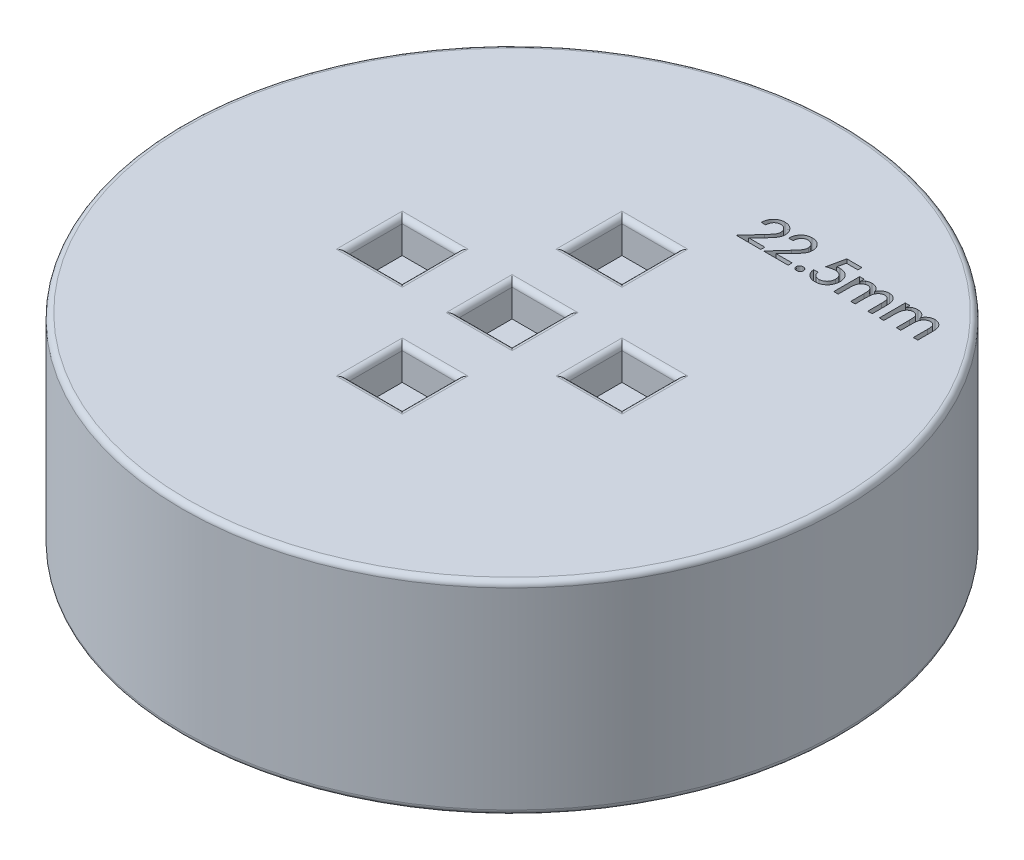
SolidWorks part; units mm, degrees
ref_plane "Front Plane" through (0, 0, 0) normal (0, 0, 1) x (1, 0, 0)
ref_plane "Top Plane" through (0, 0, 0) normal (0, 1, 0) x (1, 0, 0)
ref_plane "Right Plane" through (0, 0, 0) normal (1, 0, 0) x (0, 0, -1)
sketch "Sketch1" plane through (0, 0, 0) normal (0, 1, 0) x (1, 0, 0)
  circle A0 centre (0, 0) radius 30
extrude "Boss-Extrude1" add sketch "Sketch1" along normal blind 18.5
sketch "Sketch2" plane through (0, 18.5, 0) normal (0, 1, 0) x (1, 0, 0)
  line L0 (0, 0) -> (0, -10) construction
  line L1 (0, 0) -> (10, 0) construction
  line L2 (0, 0) -> (-10, 0) construction
  line L3 (0, 0) -> (0, 10) construction
  line L5 (-2.5, -7.5) -> (2.5, -7.5)
  line L6 (-2.5, -7.5) -> (-2.5, -12.5)
  line L7 (-2.5, -12.5) -> (2.5, -12.5)
  line L8 (2.5, -7.5) -> (2.5, -12.5)
  line L9 (-2.5, -7.5) -> (2.5, -12.5) construction
  line L10 (-2.5, -12.5) -> (2.5, -7.5) construction
  line L11 (-7.5, -2.5) -> (-12.5, -2.5)
  line L12 (-7.5, -2.5) -> (-7.5, 2.5)
  line L13 (-7.5, 2.5) -> (-12.5, 2.5)
  line L14 (-12.5, -2.5) -> (-12.5, 2.5)
  line L15 (-7.5, -2.5) -> (-12.5, 2.5) construction
  line L16 (-7.5, 2.5) -> (-12.5, -2.5) construction
  line L17 (2.5, -2.5) -> (-2.5, -2.5)
  line L18 (2.5, -2.5) -> (2.5, 2.5)
  line L19 (2.5, 2.5) -> (-2.5, 2.5)
  line L20 (-2.5, -2.5) -> (-2.5, 2.5)
  line L21 (2.5, -2.5) -> (-2.5, 2.5) construction
  line L22 (2.5, 2.5) -> (-2.5, -2.5) construction
  line L23 (-2.5, 12.5) -> (2.5, 12.5)
  line L24 (-2.5, 12.5) -> (-2.5, 7.5)
  line L25 (-2.5, 7.5) -> (2.5, 7.5)
  line L26 (2.5, 12.5) -> (2.5, 7.5)
  line L27 (-2.5, 12.5) -> (2.5, 7.5) construction
  line L28 (-2.5, 7.5) -> (2.5, 12.5) construction
  line L29 (12.5, -2.5) -> (7.5, -2.5)
  line L30 (12.5, -2.5) -> (12.5, 2.5)
  line L31 (12.5, 2.5) -> (7.5, 2.5)
  line L32 (7.5, -2.5) -> (7.5, 2.5)
  line L33 (12.5, -2.5) -> (7.5, 2.5) construction
  line L34 (12.5, 2.5) -> (7.5, -2.5) construction
  dimension "D1" = 5
  dimension "D2" = 10
  dimension "D3" = 5
  dimension "D4" = 5
  dimension "D5" = 5
  dimension "D6" = 5
  dimension "D7" = 5
  dimension "D8" = 5
extrude "Cut-Extrude1" cut sketch "Sketch2" against normal blind 3
fillet "Fillet1" radius 0.5 6 edges at (2.5, 18.5, 0) (0, 18.5, 2.5) (-12.5, 18.5, 0) (-10, 18.5, 2.5) (-7.5, 18.5, 0) (-10, 18.5, -2.5)
sketch "Sketch3" plane through (0, 18.5, 0) normal (0, 1, 0) x (1, 0, 0)
sketch "Sketch4" plane through (0, 0, 0) normal (0, -1, 0) x (-1, 0, 0)
  line L0 (0, 0) -> (-10, 0) construction
  line L1 (0, 0) -> (0, -10) construction
  line L2 (0, 0) -> (0, 10) construction
  line L3 (0, 0) -> (10, 0) construction
  line L5 (-2.5, 2.5) -> (2.5, 2.5)
  line L6 (-2.5, 2.5) -> (-2.5, -2.5)
  line L7 (-2.5, -2.5) -> (2.5, -2.5)
  line L8 (2.5, 2.5) -> (2.5, -2.5)
  line L9 (-2.5, 2.5) -> (2.5, -2.5) construction
  line L10 (-2.5, -2.5) -> (2.5, 2.5) construction
  line L11 (-2.5, -7.5) -> (2.5, -7.5)
  line L12 (-2.5, -7.5) -> (-2.5, -12.5)
  line L13 (-2.5, -12.5) -> (2.5, -12.5)
  line L14 (2.5, -7.5) -> (2.5, -12.5)
  line L15 (-2.5, -7.5) -> (2.5, -12.5) construction
  line L16 (-2.5, -12.5) -> (2.5, -7.5) construction
  line L17 (7.5, 2.5) -> (12.5, 2.5)
  line L18 (7.5, 2.5) -> (7.5, -2.5)
  line L19 (7.5, -2.5) -> (12.5, -2.5)
  line L20 (12.5, 2.5) -> (12.5, -2.5)
  line L21 (7.5, 2.5) -> (12.5, -2.5) construction
  line L22 (7.5, -2.5) -> (12.5, 2.5) construction
  line L23 (-12.5, 2.5) -> (-7.5, 2.5)
  line L24 (-12.5, 2.5) -> (-12.5, -2.5)
  line L25 (-12.5, -2.5) -> (-7.5, -2.5)
  line L26 (-7.5, 2.5) -> (-7.5, -2.5)
  line L27 (-12.5, 2.5) -> (-7.5, -2.5) construction
  line L28 (-12.5, -2.5) -> (-7.5, 2.5) construction
  line L29 (2.5, 7.5) -> (-2.5, 7.5)
  line L30 (2.5, 7.5) -> (2.5, 12.5)
  line L31 (2.5, 12.5) -> (-2.5, 12.5)
  line L32 (-2.5, 7.5) -> (-2.5, 12.5)
  line L33 (2.5, 7.5) -> (-2.5, 12.5) construction
  line L34 (2.5, 12.5) -> (-2.5, 7.5) construction
  dimension "D1" = 5
  dimension "D2" = 5
  dimension "D3" = 5
  dimension "D4" = 5
  dimension "D5" = 5
  dimension "D6" = 5
extrude "Cut-Extrude2" cut sketch "Sketch4" against normal blind 3
fillet "Fillet2" radius 0.5 21 edges at (0, 0, 30) (2.5, 0, 0) (0, 0, 2.5) (-2.5, 0, 0) (0, 0, -2.5) (2.5, 0, 10) (0, 0, 12.5) (-2.5, 0, 10) (0, 0, 7.5) (-7.5, 0, 0) (-10, 0, 2.5) (-12.5, 0, 0) (-10, 0, -2.5) (12.5, 0, 0) (10, 0, 2.5) (7.5, 0, 0) (10, 0, -2.5) (-2.5, 0, -10) (0, 0, -12.5) (2.5, 0, -10) (0, 0, -7.5)
fillet "Fillet3" radius 0.5 15 edges at (0, 18.5, 30) (0, 18.5, 7.5) (-2.5, 18.5, 10) (0, 18.5, 12.5) (2.5, 18.5, 10) (-2.5, 18.5, 0.25) (0.25, 18.5, -2.5) (0, 18.5, -12.5) (-2.5, 18.5, -10) (0, 18.5, -7.5) (2.5, 18.5, -10) (10, 18.5, 2.5) (12.5, 18.5, 0) (10, 18.5, -2.5) (7.5, 18.5, 0)
sketch "Sketch5" plane through (0, 18.5, 0) normal (0, 1, 0) x (1, 0, 0)
  text T0 "<b>22.5mm</b>"
extrude "Cut-Extrude3" cut sketch "Sketch5" against normal blind 2
